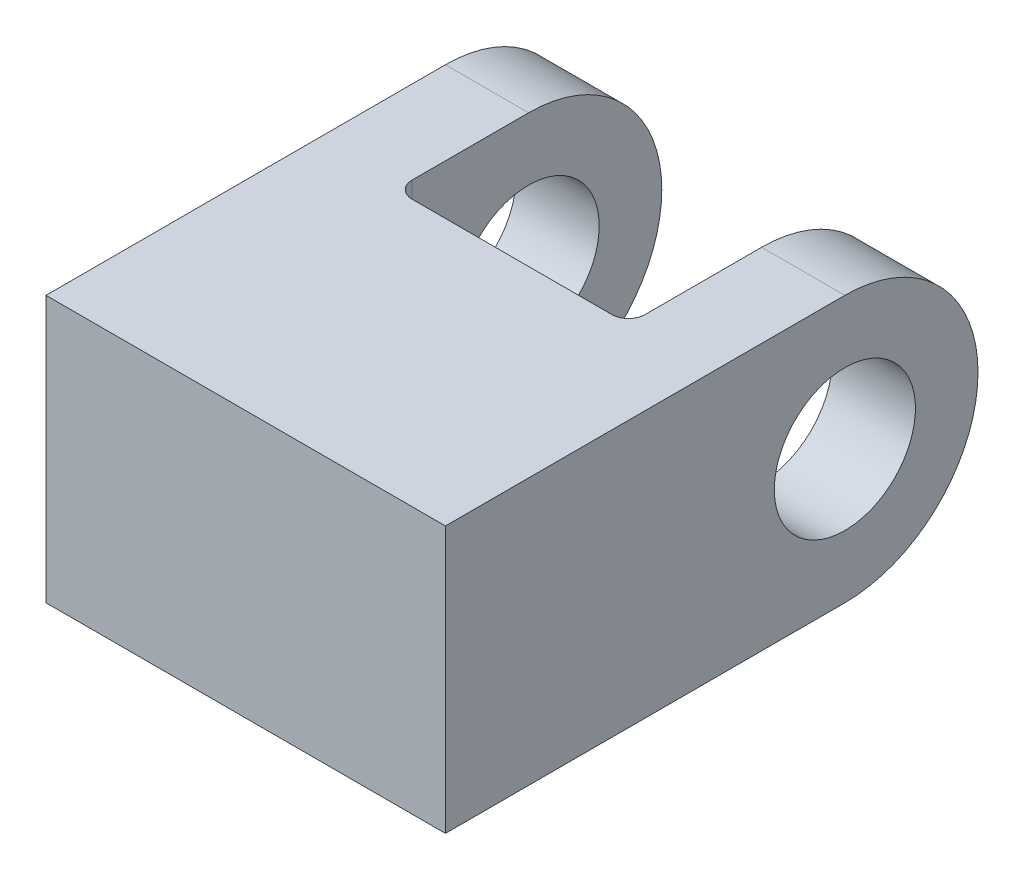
SolidWorks part; units mm, degrees
ref_plane "Front Plane" through (0, 0, 0) normal (0, 0, 1) x (1, 0, 0)
ref_plane "Top Plane" through (0, 0, 0) normal (0, 1, 0) x (1, 0, 0)
ref_plane "Right Plane" through (0, 0, 0) normal (1, 0, 0) x (0, 0, -1)
sketch "Sketch1" plane through (0, 0, 0) normal (1, 0, 0) x (0, 0, -1)
  line L0 (0, 12.7) -> (-38.1, 12.7)
  line L1 (-38.1, 12.7) -> (-38.1, -12.7)
  line L2 (-38.1, -12.7) -> (0, -12.7)
  line L3 (0, -12.7) -> (0, 12.7) construction
  arc A0 (0, -12.7) -> (0, 12.7) centre (0, 0) ccw
  circle A1 centre (0, 0) radius 6.731
  point P8 (0, 0)
  dimension "D2" = 13.462
  dimension "D3" = 12.7
  dimension "D1" = 38.1
extrude "Boss-Extrude1" add sketch "Sketch1" along normal mid plane 38.1
sketch "Sketch2" plane through (0, 12.7, 0) normal (0, 1, 0) x (1, 0, 0)
  line L1 (-11.1125, 15.875) -> (11.1125, 15.875)
  line L2 (-11.1125, 15.875) -> (-11.1125, -12.7)
  line L3 (-11.1125, -12.7) -> (11.1125, -12.7)
  line L4 (11.1125, 15.875) -> (11.1125, -12.7)
  line L5 (-11.1125, 15.875) -> (11.1125, -12.7) construction
  line L6 (-11.1125, -12.7) -> (11.1125, 15.875) construction
  line L8 (0, 0) -> (0, 1.5875) construction
  line L9 (19.05, 0) -> (-19.05, 0) construction
  point P8 (0, 1.6737)
  dimension "D1" = 22.225
  dimension "D2" = 28.575
  dimension "D3" = 1.5875
extrude "Cut-Extrude1" cut sketch "Sketch2" against normal through all
fillet "Fillet1" radius 1.5875 2 edges at (11.1125, 0, 12.7) (-11.1125, 0, 12.7)
